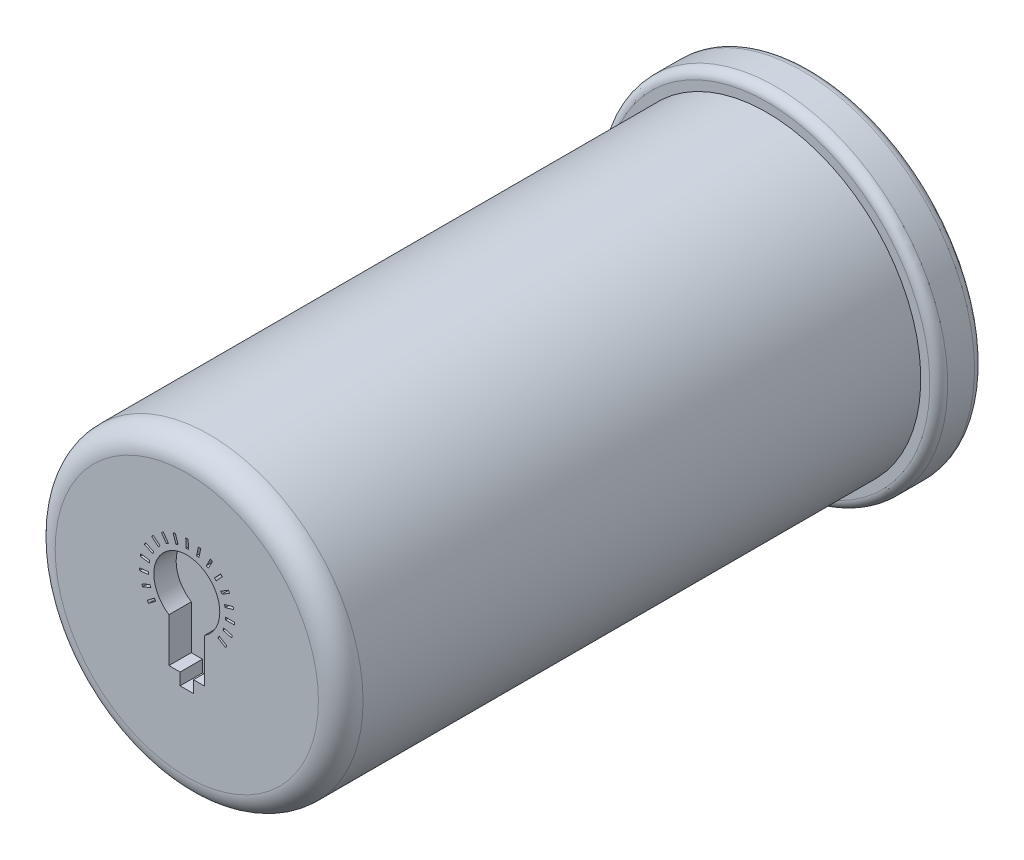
SolidWorks part; units mm, degrees
ref_plane "Plan de face" through (0, 0, 0) normal (0, 0, 1) x (1, 0, 0)
ref_plane "Plan de dessus" through (0, 0, 0) normal (0, 1, 0) x (1, 0, 0)
ref_plane "Plan de droite" through (0, 0, 0) normal (1, 0, 0) x (0, 0, -1)
sketch "Esquisse1" plane through (0, 0, 0) normal (0, 0, 1) x (1, 0, 0)
  circle A0 centre (0, 0) radius 3.45
  dimension "D1" = 6.9
extrude "Extrusion1" add sketch "Esquisse1" along normal blind 13
fillet "Congé1" radius 0.5 1 edges at (3.45, 0, 13)
sketch "Esquisse2" plane through (0, 0, 13) normal (0, 0, 1) x (1, 0, 0)
  line L0 (0, 0) -> (0, 2.4235) construction
  line L1 (0.8973, 0.0437) -> (0.8696, -0.0023)
  line L2 (1.0192, 0.3042) -> (1.0049, 0.2524)
  line L3 (-0.4, -0.9869) -> (-0.15, -0.9869)
  line L4 (0.4, 0) -> (0.4, -0.9869)
  line L5 (0.8121, 0.3057) -> (1.0049, 0.2524)
  line L6 (0.8264, 0.3574) -> (1.0192, 0.3042)
  line L7 (-0.15, -1.2554) -> (0.15, -1.2554)
  line L8 (0.15, -0.9869) -> (0.15, -1.2554)
  line L9 (-0.15, -0.9869) -> (-0.15, -1.2554)
  line L10 (-0.4, 0) -> (-0.4, -0.9869)
  line L11 (0.15, -0.9869) -> (0.4, -0.9869)
  line L12 (0.8264, 0.3574) -> (0.8121, 0.3057)
  line L13 (0.6982, 0.1007) -> (0.8696, -0.0023)
  line L14 (0.7259, 0.1467) -> (0.8973, 0.0437)
  line L15 (0.7259, 0.1467) -> (0.6982, 0.1007)
  line L16 (1.0667, 0.5878) -> (1.0669, 0.5341)
  line L17 (0.8669, 0.5337) -> (1.0669, 0.5341)
  line L18 (0.8667, 0.5874) -> (1.0667, 0.5878)
  line L19 (0.8667, 0.5874) -> (0.8669, 0.5337)
  line L20 (1.0365, 0.8738) -> (1.051, 0.8221)
  line L21 (0.8584, 0.768) -> (1.051, 0.8221)
  line L22 (0.8439, 0.8197) -> (1.0365, 0.8738)
  line L23 (0.8439, 0.8197) -> (0.8584, 0.768)
  line L24 (0.9306, 1.1412) -> (0.9584, 1.0953)
  line L25 (0.7874, 0.9915) -> (0.9584, 1.0953)
  line L26 (0.7596, 1.0374) -> (0.9306, 1.1412)
  line L27 (0.7596, 1.0374) -> (0.7874, 0.9915)
  line L28 (0.7568, 1.3703) -> (0.796, 1.3336)
  line L29 (0.6591, 1.1877) -> (0.796, 1.3336)
  line L30 (0.6199, 1.2245) -> (0.7568, 1.3703)
  line L31 (0.6199, 1.2245) -> (0.6591, 1.1877)
  line L32 (0.528, 1.5445) -> (0.5755, 1.5196)
  line L33 (0.4828, 1.3424) -> (0.5755, 1.5196)
  line L34 (0.4352, 1.3673) -> (0.528, 1.5445)
  line L35 (0.4352, 1.3673) -> (0.4828, 1.3424)
  line L36 (0.2608, 1.6508) -> (0.3133, 1.6396)
  line L37 (0.2715, 1.444) -> (0.3133, 1.6396)
  line L38 (0.219, 1.4552) -> (0.2608, 1.6508)
  line L39 (0.219, 1.4552) -> (0.2715, 1.444)
  line L40 (-0.0252, 1.6816) -> (0.0284, 1.6849)
  line L41 (0.0406, 1.4852) -> (0.0284, 1.6849)
  line L42 (-0.013, 1.482) -> (-0.0252, 1.6816)
  line L43 (-0.013, 1.482) -> (0.0406, 1.4852)
  line L44 (-0.3089, 1.6345) -> (-0.2581, 1.6521)
  line L45 (-0.1928, 1.463) -> (-0.2581, 1.6521)
  line L46 (-0.2436, 1.4455) -> (-0.3089, 1.6345)
  line L47 (-0.2436, 1.4455) -> (-0.1928, 1.463)
  line L48 (-0.5695, 1.5131) -> (-0.5253, 1.5436)
  line L49 (-0.4117, 1.379) -> (-0.5253, 1.5436)
  line L50 (-0.4559, 1.3485) -> (-0.5695, 1.5131)
  line L51 (-0.4559, 1.3485) -> (-0.4117, 1.379)
  line L52 (-0.7881, 1.3261) -> (-0.7537, 1.3674)
  line L53 (-0.6001, 1.2393) -> (-0.7537, 1.3674)
  line L54 (-0.6344, 1.1981) -> (-0.7881, 1.3261)
  line L55 (-0.6344, 1.1981) -> (-0.6001, 1.2393)
  line L56 (-0.9484, 1.0874) -> (-0.9264, 1.1364)
  line L57 (-0.744, 1.0542) -> (-0.9264, 1.1364)
  line L58 (-0.7661, 1.0053) -> (-0.9484, 1.0874)
  line L59 (-0.7661, 1.0053) -> (-0.744, 1.0542)
  line L60 (-1.0389, 0.8144) -> (-1.0308, 0.8675)
  line L61 (-0.8331, 0.8373) -> (-1.0308, 0.8675)
  line L62 (-0.8412, 0.7842) -> (-1.0389, 0.8144)
  line L63 (-0.8412, 0.7842) -> (-0.8331, 0.8373)
  line L64 (-1.0528, 0.5272) -> (-1.0592, 0.5805)
  line L65 (-0.8606, 0.6045) -> (-1.0592, 0.5805)
  line L66 (-0.8542, 0.5511) -> (-1.0528, 0.5272)
  line L67 (-0.8542, 0.5511) -> (-0.8606, 0.6045)
  line L68 (-0.9891, 0.2468) -> (-1.0096, 0.2964)
  line L69 (-0.8247, 0.3727) -> (-1.0096, 0.2964)
  line L70 (-0.8042, 0.3231) -> (-0.9891, 0.2468)
  line L71 (-0.8042, 0.3231) -> (-0.8247, 0.3727)
  line L72 (-0.8525, -0.0063) -> (-0.8856, 0.036)
  line L73 (-0.728, 0.1591) -> (-0.8856, 0.036)
  line L74 (-0.6949, 0.1168) -> (-0.8525, -0.0063)
  line L75 (-0.6949, 0.1168) -> (-0.728, 0.1591)
  arc A0 (0.4, 0) -> (-0.4, 0) centre (0, 0.6212) ccw
  dimension "D1" = 0.8
  dimension "D2" = 0.3
  dimension "D3" = 0.2
extrude "Enlèv. mat.-Extru.1" cut sketch "Esquisse2" against normal blind 0.5
sketch "Esquisse3" plane through (0, 0, 0) normal (0, 0, -1) x (-1, 0, 0)
  circle A0 centre (0, 0) radius 3.8532
extrude "Extrusion2" add sketch "Esquisse3" along normal blind 1
fillet "Congé2" radius 0.2 2 edges at (-3.8532, 0, 0) (-3.8532, 0, -1)
